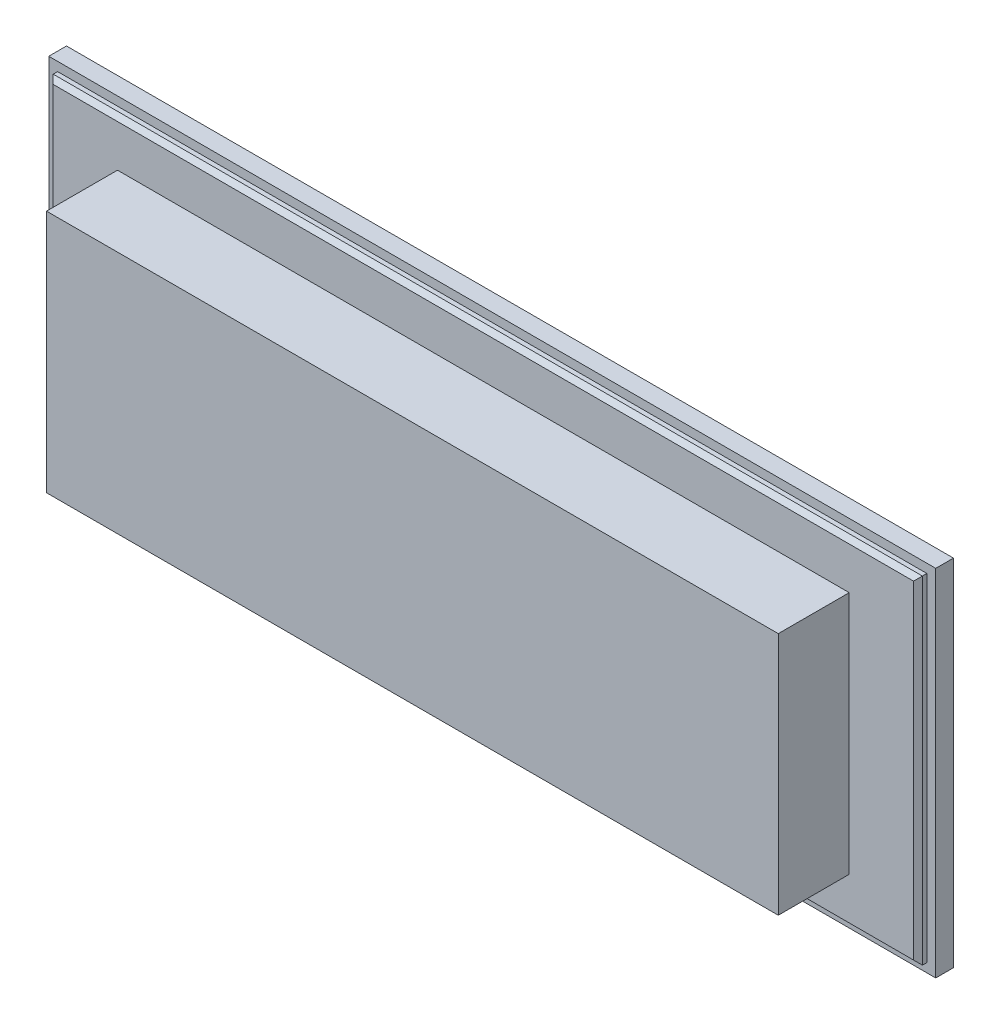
SolidWorks part; units mm, degrees
ref_plane "Ebene vorne" through (0, 0, 0) normal (0, 0, 1) x (1, 0, 0)
ref_plane "Ebene oben" through (0, 0, 0) normal (0, 1, 0) x (1, 0, 0)
ref_plane "Ebene rechts" through (0, 0, 0) normal (1, 0, 0) x (0, 0, -1)
sketch "Skizze1" plane through (0, 0, 0) normal (0, 0, 1) x (1, 0, 0)
  line L1 (-100, -40) -> (100, -40)
  line L2 (-100, -40) -> (-100, 40)
  line L3 (-100, 40) -> (100, 40)
  line L4 (100, -40) -> (100, 40)
  line L5 (-100, -40) -> (100, 40) construction
  line L6 (-100, 40) -> (100, -40) construction
  point P0 (0, 0)
  dimension "D1" = 200
  dimension "D2" = 80
extrude "Aufsatz-Linear austragen1" add sketch "Skizze1" along normal blind 4
sketch "Skizze2" plane through (0, 0, 4) normal (0, 0, 1) x (1, 0, 0)
  line L0 (100, -40) -> (100, 40) construction
  line L1 (-98, -38) -> (98, -38)
  line L2 (-98, -38) -> (-98, 38)
  line L3 (-98, 38) -> (98, 38)
  line L4 (98, -38) -> (98, 38)
  line L5 (-98, -38) -> (98, 38) construction
  line L6 (-98, 38) -> (98, -38) construction
  line L7 (100, 40) -> (-100, 40) construction
  point P0 (0, 0)
  dimension "D1" = 2
  dimension "D2" = 2
extrude "Aufsatz-Linear austragen2" add sketch "Skizze2" along normal blind 2
chamfer "Fase1" distance 1 angle 45 4 edges at (0, -38, 6) (-98, 0, 6) (0, 38, 6) (98, 0, 6)
sketch "Skizze3" plane through (0, 0, 6) normal (0, 0, 1) x (1, 0, 0)
  line L1 (-82.5, -27.5) -> (82.5, -27.5)
  line L2 (-82.5, -27.5) -> (-82.5, 27.5)
  line L3 (-82.5, 27.5) -> (82.5, 27.5)
  line L4 (82.5, -27.5) -> (82.5, 27.5)
  line L5 (-82.5, -27.5) -> (82.5, 27.5) construction
  line L6 (-82.5, 27.5) -> (82.5, -27.5) construction
  point P0 (0, 0)
  dimension "D1" = 55
  dimension "D2" = 165
extrude "Aufsatz-Linear austragen3" add sketch "Skizze3" along normal blind 16
